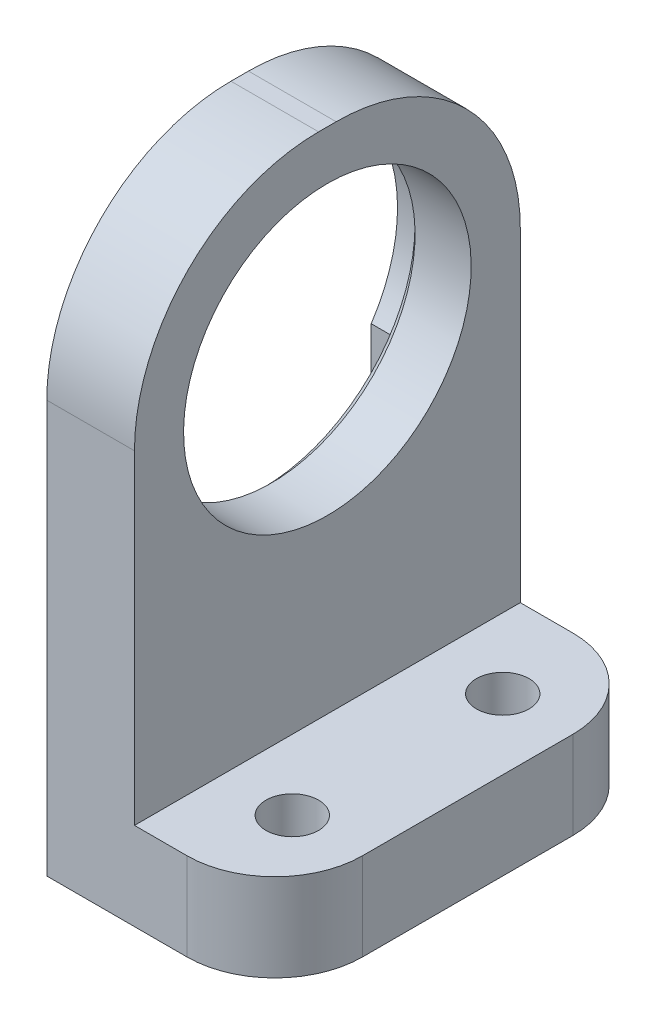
SolidWorks part; units mm, degrees
ref_plane "Plan de face" through (0, 0, 0) normal (0, 0, 1) x (1, 0, 0)
ref_plane "Plan de dessus" through (0, 0, 0) normal (0, 1, 0) x (1, 0, 0)
ref_plane "Plan de droite" through (0, 0, 0) normal (1, 0, 0) x (0, 0, -1)
sketch "Esquisse1" plane through (0, 0, 0) normal (0, 0, 1) x (1, 0, 0)
  line L0 (0, 0) -> (0, 34)
  line L1 (0, 34) -> (5, 34)
  line L2 (5, 34) -> (5, 5)
  line L3 (5, 5) -> (13, 5)
  line L4 (13, 5) -> (13, 0)
  line L5 (13, 0) -> (0, 0)
  dimension "D1" = 5
  dimension "D2" = 5
  dimension "D3" = 13
  dimension "D4" = 34
extrude "Boss.-Extru.1" add sketch "Esquisse1" along normal blind 22
sketch "Esquisse2" plane through (5, 0, 0) normal (1, 0, 0) x (0, 0, -1)
  line L0 (-11, 35.0839) -> (-11, 13.5698) construction
  line L1 (-22, 5) -> (-22, 34) construction
  line L3 (-22, 0) -> (0, 0) construction
  circle A0 centre (-11, 23) radius 8.2
  dimension "D3" = 16.4
  dimension "D1" = 11
  dimension "D2" = 23
extrude "Enlèv. mat.-Extru.1" cut sketch "Esquisse2" against normal through all
fillet "Congé1" radius 10.5 2 edges at (2.5, 34, 0) (2.5, 34, 22)
sketch "Esquisse3" plane through (0, 0, 0) normal (-1, 0, 0) x (0, 0, 1)
  line L0 (11, 23) -> (11, 6.1606) construction
  line L3 (3.5, 18.0251) -> (3.5, -2.1816)
  line L4 (3.5, -2.1816) -> (18.5, -2.1816)
  line L5 (18.5, 18.0251) -> (18.5, -2.1816)
  arc A0 (18.5, 18.0251) -> (3.5, 18.0251) centre (11, 23) ccw
  dimension "D1" = 18
  dimension "D2" = 15
  dimension "D3" = 7.5
extrude "Enlèv. mat.-Extru.2" cut sketch "Esquisse3" against normal blind 1.3
sketch "Esquisse4" plane through (0, 5, 0) normal (0, 1, 0) x (1, 0, 0)
  line L0 (13, -22) -> (13, 0) construction
  line L1 (13, 0) -> (5, 0) construction
  line L2 (13, -22) -> (5, -22) construction
  circle A0 centre (9, -5) radius 1.5
  circle A1 centre (9, -17) radius 1.5
  dimension "D1" = 3
  dimension "D2" = 3
  dimension "D3" = 4
  dimension "D4" = 5
  dimension "D5" = 5
extrude "Enlèv. mat.-Extru.3" cut sketch "Esquisse4" against normal through all
fillet "Congé3" radius 5 2 edges at (13, 2.5, 0) (13, 2.5, 22)
chamfer "Chanfrein1" distance 0.5 angle 45 1 edges at (1.3, 23, 19.2)
